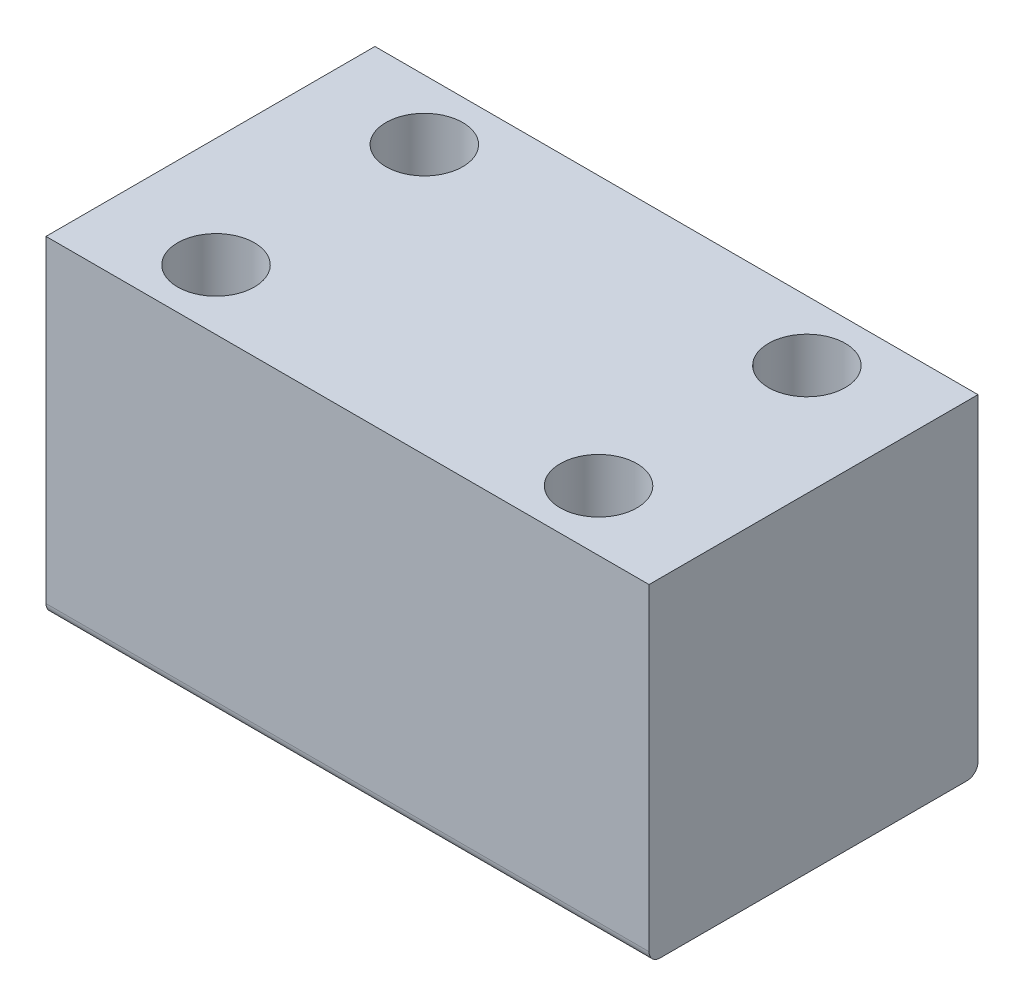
SolidWorks part; units mm, degrees
ref_plane "Piano frontale" through (0, 0, 0) normal (0, 0, 1) x (1, 0, 0)
ref_plane "Piano superiore" through (0, 0, 0) normal (0, 1, 0) x (1, 0, 0)
ref_plane "Piano destro" through (0, 0, 0) normal (1, 0, 0) x (0, 0, -1)
sketch "Schizzo1" plane through (0, 0, 0) normal (1, 0, 0) x (0, 0, -1)
  line L1 (-15, -15) -> (15, -15)
  line L2 (-15, -15) -> (-15, 15)
  line L3 (-15, 15) -> (15, 15)
  line L4 (15, -15) -> (15, 15)
  line L5 (-15, -15) -> (15, 15) construction
  line L6 (-15, 15) -> (15, -15) construction
  circle A0 centre (0, 0) radius 3.5
  point P0 (0, 0)
extrude "Estrusione-Estrusione1" add sketch "Schizzo1" along normal blind 55 contours L4 L3 L2 L1
ref_plane "Piano1" through (55, 15, -15) normal (-1, 0, 0) x (0, 0, 1)
hole_wizard "Foro filettato M8x1.0-1" positions "Schizzo5" profile "Schizzo4" tap size "M8x1.0" standard "Ansi Metric"
sketch "Schizzo5" plane through (0, 0, 0) normal (-1, 0, 0) x (0, 0, 1)
  point P0 (0, 0)
sketch "Schizzo4" plane through (0, 0, 0) normal (0, 1, 0) x (0, 0, 1)
  line L0 (0, 0) -> (0, 33.103)
  line L1 (0, 33.103) -> (3.5, 31)
  line L2 (3.5, 31) -> (3.5, 0)
  line L5 (3.5, 0) -> (0, 0)
  line L10 (0, 33.103) -> (-3.5, 31) construction
  line L11 (0, -6.35) -> (0, 107.95) construction
  dimension "Tap Drill Dia." = 7
  dimension "Tap Drill Depth" = 31
  dimension "Drill Angle" = 118
sketch "Schizzo8" plane through (0, 15, 0) normal (0, 1, 0) x (1, 0, 0)
  line L7 (10.0051, 9.5) -> (10.0051, -9.5) construction
  line L9 (54.8952, 9.5) -> (54.8952, -9.5) construction
hole_wizard "Foro filettato M8x1.0-3" positions "Schizzo10" profile "Schizzo9" tap size "M8x1.0" standard "Ansi Metric"
sketch "Schizzo10" plane through (0, 15, 0) normal (0, 1, 0) x (1, 0, 0)
  point P0 (10.0051, 9.5)
  point P3 (10.0051, -9.5)
  point P6 (44.8952, -9.5)
  point P9 (44.8952, 9.5)
sketch "Schizzo9" plane through (10.0051, 15, -9.5) normal (1, 0, 0) x (0, 0, 1)
  line L0 (0, 0) -> (0, 23.103)
  line L1 (0, 23.103) -> (3.5, 21)
  line L2 (3.5, 21) -> (3.5, 0)
  line L5 (3.5, 0) -> (0, 0)
  line L10 (0, 23.103) -> (-3.5, 21) construction
  line L11 (0, -6.35) -> (0, 107.95) construction
  dimension "Tap Drill Dia." = 7
  dimension "Tap Drill Depth" = 21
  dimension "Drill Angle" = 118
sketch "Schizzo11" plane through (0, 15, 0) normal (0, 1, 0) x (1, 0, 0)
  point P0 (10.0051, 9.5)
  point P1 (10.0051, -9.5)
  point P3 (54.8952, -9.5)
  point P5 (54.8952, 9.5)
fillet "Raccordo1" radius 1 1 edges at (27.5, -15, 15)
fillet "Raccordo3" radius 1 1 edges at (27.5, -15, -15)
